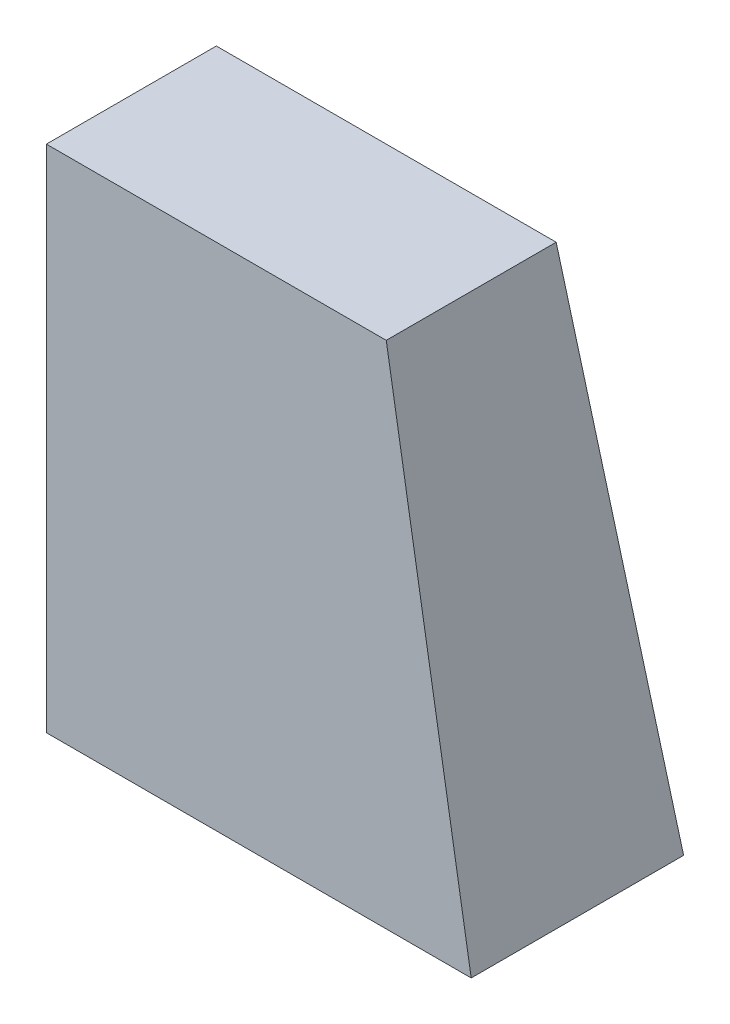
SolidWorks part; units mm, degrees
ref_plane "Front Plane" through (0, 0, 0) normal (0, 0, 1) x (1, 0, 0)
ref_plane "Top Plane" through (0, 0, 0) normal (0, 1, 0) x (1, 0, 0)
ref_plane "Right Plane" through (0, 0, 0) normal (1, 0, 0) x (0, 0, -1)
sketch "Sketch1" plane through (0, 0, 0) normal (0, 1, 0) x (1, 0, 0)
  line L1 (0, 0) -> (127, 0)
  line L2 (0, 0) -> (0, 63.5)
  line L3 (0, 63.5) -> (127, 63.5)
  line L4 (127, 0) -> (127, 63.5)
  dimension "D1" = 127
  dimension "D2" = 63.5
ref_plane "Plane1" through (0, 152.4, 0) normal (0, 1, 0) x (-1, 0, 0)
sketch "Sketch2" plane through (0, 152.4, 0) normal (0, 1, 0) x (-1, 0, 0)
  line L1 (0, 0) -> (-101.6, 0)
  line L2 (0, 0) -> (0, -50.8)
  line L3 (0, -50.8) -> (-101.6, -50.8)
  line L4 (-101.6, 0) -> (-101.6, -50.8)
  dimension "D1" = 101.6
  dimension "D2" = 50.8
sketch "Sketch3" plane through (0, 0, 0) normal (0, 0, 1) x (1, 0, 0)
  arc A0 (0, 0) -> (0, 152.4) centre (136.9458, 76.2) cw
sketch "Sketch4" plane through (0, 0, 0) normal (1, 0, 0) x (0, 0, -1)
  spline S0 degree 3 poles (63.5, 0) (71.2147, 14.503) (88.5927, 47.1719) (32.3614, 88.0604) (44.3452, 129.8767) (50.8, 152.4) knots 0 0 0 0 0.26919 0.606369 1 1 1 1
loft "Loft2" add profiles "Sketch1", "Sketch2"
